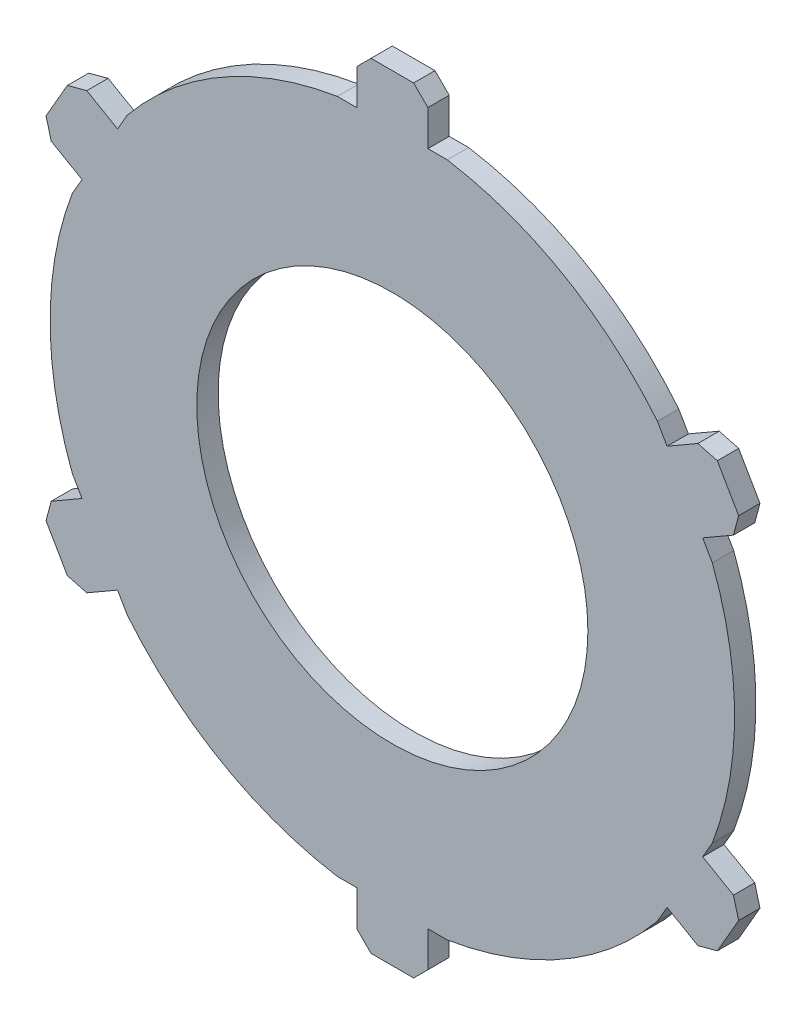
SolidWorks part; units mm, degrees
ref_plane "Face" through (0, 0, 0) normal (0, 0, 1) x (1, 0, 0)
ref_plane "Dessus" through (0, 0, 0) normal (0, 1, 0) x (1, 0, 0)
ref_plane "Droite" through (0, 0, 0) normal (1, 0, 0) x (0, 0, -1)
sketch "Esquisse1" plane through (0, 0, 0) normal (0, 0, 1) x (1, 0, 0)
  line L0 (0, 211.9537) -> (0, -211.4442) construction
  line L1 (-20, 210) -> (-12, 218)
  line L2 (-12, 218) -> (12, 218)
  line L3 (-20, 210) -> (-20, 191.4582)
  line L4 (171.8653, 122.3205) -> (182.7935, 119.3923)
  line L5 (20, 210) -> (20, 191.4582)
  line L6 (12, 218) -> (20, 210)
  line L7 (182.7935, 119.3923) -> (194.7935, 98.6077)
  line L8 (171.8653, 122.3205) -> (155.8077, 113.0496)
  line L9 (191.8653, 87.6795) -> (175.8077, 78.4086)
  line L10 (194.7935, 98.6077) -> (191.8653, 87.6795)
  line L11 (191.8653, -87.6795) -> (194.7935, -98.6077)
  line L12 (194.7935, -98.6077) -> (182.7935, -119.3923)
  line L13 (191.8653, -87.6795) -> (175.8077, -78.4086)
  line L14 (171.8653, -122.3205) -> (155.8077, -113.0496)
  line L15 (182.7935, -119.3923) -> (171.8653, -122.3205)
  line L16 (20, -210) -> (12, -218)
  line L17 (12, -218) -> (-12, -218)
  line L18 (20, -210) -> (20, -191.4582)
  line L19 (-20, -210) -> (-20, -191.4582)
  line L20 (-12, -218) -> (-20, -210)
  line L21 (-171.8653, -122.3205) -> (-182.7935, -119.3923)
  line L22 (-182.7935, -119.3923) -> (-194.7935, -98.6077)
  line L23 (-171.8653, -122.3205) -> (-155.8077, -113.0496)
  line L24 (-191.8653, -87.6795) -> (-175.8077, -78.4086)
  line L25 (-194.7935, -98.6077) -> (-191.8653, -87.6795)
  line L26 (-191.8653, 87.6795) -> (-194.7935, 98.6077)
  line L27 (-194.7935, 98.6077) -> (-182.7935, 119.3923)
  line L28 (-191.8653, 87.6795) -> (-175.8077, 78.4086)
  line L29 (-171.8653, 122.3205) -> (-155.8077, 113.0496)
  line L30 (-182.7935, 119.3923) -> (-171.8653, 122.3205)
  arc A0 (-20, 191.4582) -> (-155.8077, 113.0496) centre (0, 0) ccw
  circle A1 centre (0, 0) radius 110
  arc A2 (155.8077, 113.0496) -> (20, 191.4582) centre (0, 0) ccw
  arc A3 (175.8077, -78.4086) -> (175.8077, 78.4086) centre (0, 0) ccw
  arc A4 (20, -191.4582) -> (155.8077, -113.0496) centre (0, 0) ccw
  arc A5 (-155.8077, -113.0496) -> (-20, -191.4582) centre (0, 0) ccw
  arc A6 (-175.8077, 78.4086) -> (-175.8077, -78.4086) centre (0, 0) ccw
  point P6 (-20, 218)
  point P9 (20, 218)
  point P17 (178.7935, 126.3205)
  point P18 (198.7935, 91.6795)
  point P25 (198.7935, -91.6795)
  point P26 (178.7935, -126.3205)
  point P33 (20, -218)
  point P34 (-20, -218)
  point P41 (-178.7935, -126.3205)
  point P42 (-198.7935, -91.6795)
  point P49 (-198.7935, 91.6795)
  point P50 (-178.7935, 126.3205)
  dimension "D1" = 220
  dimension "D2" = 385
  dimension "D3" = 20
  dimension "D4" = 20
  dimension "D5" = 218
  dimension "D8" = 8
  dimension "D9" = 8
extrude "Extrusion1" add sketch "Esquisse1" along normal blind 12
sketch "Esquisse2" plane through (0, 0, 12) normal (0, 0, 1) x (1, 0, 0)
  line L1 (-20, 210) -> (-51.2398, 210)
  line L2 (-20, 210) -> (-20, 190)
  line L3 (-20, 190) -> (-51.2398, 190)
  line L4 (-51.2398, 210) -> (-51.2398, 190)
  line L5 (20, 210) -> (53.2182, 210)
  line L6 (20, 210) -> (20, 190)
  line L7 (20, 190) -> (53.2182, 190)
  line L8 (53.2182, 210) -> (53.2182, 190)
  circle A0 centre (0, 0) radius 110 construction
  dimension "D1" = 190
extrude "Enlèv. mat.-Extru.1" cut sketch "Esquisse2" against normal blind 12
pattern_circular "Répétition circulaire1" count 6 every 60 about axis through (0, 0, 0) along (0, 0, 1) of "Enlèv. mat.-Extru.1"
